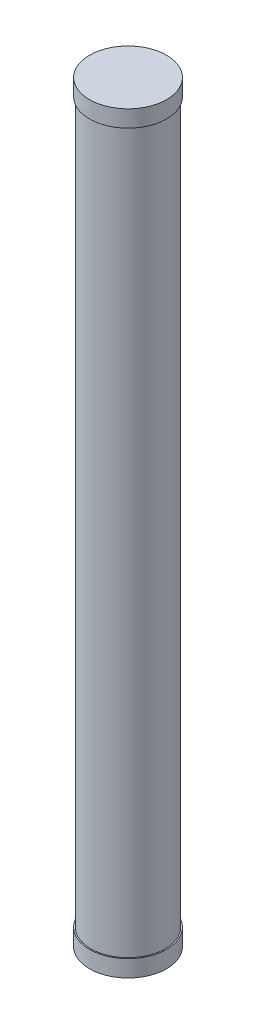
SolidWorks part; units mm, degrees
ref_plane "Alzado" through (0, 0, 0) normal (0, 0, 1) x (1, 0, 0)
ref_plane "Planta" through (0, 0, 0) normal (0, 1, 0) x (1, 0, 0)
ref_plane "Vista lateral" through (0, 0, 0) normal (1, 0, 0) x (0, 0, -1)
sketch "Croquis2" plane through (0, 0, 0) normal (0, 1, 0) x (1, 0, 0)
  circle A0 centre (0, 0) radius 30
  dimension "D1" = 60
extrude "Saliente-Extruir1" add sketch "Croquis2" along normal mid plane 603
sketch "Croquis3" plane through (0, 301.5, 0) normal (0, 1, 0) x (1, 0, 0)
  circle A0 centre (0, 0) radius 31
  dimension "D1" = 62
extrude "Saliente-Extruir2" add sketch "Croquis3" along normal blind 1.5 separate body
sketch "Croquis4" plane through (0, 301.5, 0) normal (0, -1, 0) x (1, 0, 0)
  circle A0 centre (0, 0) radius 31
  circle A1 centre (0, 0) radius 30
  circle A2 centre (0, 0) radius 31 construction
extrude "Saliente-Extruir3" add sketch "Croquis4" along normal blind 12
mirror "Simetría2" about plane through (0, 0, 0) normal (0, 1, 0)
ref_plane "Plano1" through (0, 0, 0) normal (0, 0, 1) x (1, 0, 0)
